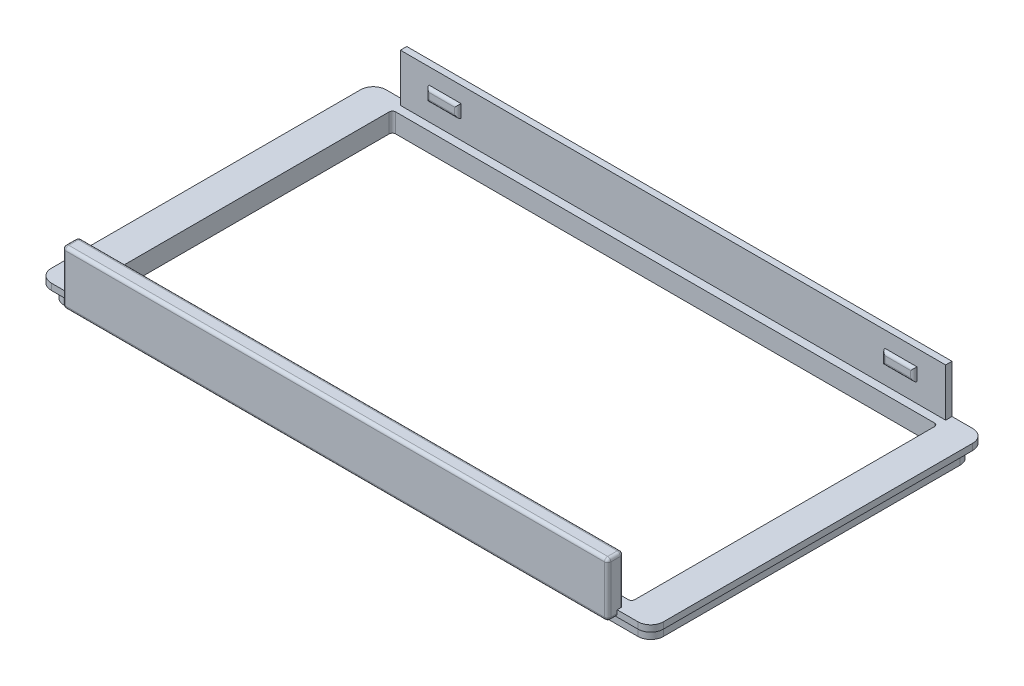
SolidWorks part; units mm, degrees
ref_plane "Спереди" through (0, 0, 0) normal (0, 0, 1) x (1, 0, 0)
ref_plane "Сверху" through (0, 0, 0) normal (0, 1, 0) x (1, 0, 0)
ref_plane "Справа" through (0, 0, 0) normal (1, 0, 0) x (0, 0, -1)
sketch "Эскиз5" plane through (0, 0, 0) normal (0, 1, 0) x (1, 0, 0)
  line L0 (46.5204, 44.0023) -> (46.5204, 145.0023)
  line L1 (46.5204, 145.0023) -> (234.5204, 145.0023)
  line L2 (234.5204, 145.0023) -> (234.5204, 44.0023)
  line L3 (234.5204, 44.0023) -> (46.5204, 44.0023)
extrude "Бобышка-Вытянуть3" add sketch "Эскиз5" along normal blind 21
sketch "Эскиз6" plane through (0, 21, 0) normal (0, 1, 0) x (1, 0, 0)
  line L0 (46.5204, 145.0023) -> (46.5204, 147.0023)
  line L1 (46.5204, 147.0023) -> (44.5204, 147.0023)
  line L2 (44.5204, 147.0023) -> (44.5204, 42.0023)
  line L3 (44.5204, 42.0023) -> (236.5204, 42.0023)
  line L4 (236.5204, 42.0023) -> (236.5204, 147.0023)
  line L5 (236.5204, 147.0023) -> (44.5204, 147.0023)
extrude "Бобышка-Вытянуть4" add sketch "Эскиз6" against normal blind 17
sketch "Эскиз7" plane through (0, 0, 0) normal (0, -1, 0) x (-1, 0, 0)
  line L0 (-46.5204, 44.0023) -> (-46.5204, 46.5023)
  line L1 (-46.5204, 145.0023) -> (-46.5204, 44.0023) construction
  line L2 (-46.5204, 46.5023) -> (-55.0204, 46.5023)
  line L3 (-55.0204, 46.5023) -> (-226.0204, 46.5023)
  line L4 (-226.0204, 46.5023) -> (-226.0204, 142.5023)
  line L5 (-226.0204, 142.5023) -> (-55.0204, 142.5023)
  line L6 (-55.0204, 142.5023) -> (-55.0204, 46.5023)
  line L7 (-234.5204, 142.5023) -> (-226.0204, 142.5023)
  line L8 (-234.5204, 44.0023) -> (-234.5204, 145.0023) construction
  line L9 (-226.0204, 142.5023) -> (-226.0204, 145.0023)
  line L10 (-234.5204, 145.0023) -> (-46.5204, 145.0023) construction
extrude "Вырез-Вытянуть2" cut sketch "Эскиз7" against normal blind 36 contours L6 L5 L4 L3
sketch "Эскиз9" plane through (0, 21, 0) normal (0, 1, 0) x (1, 0, 0)
  line L0 (226.0204, 44.0023) -> (226.0204, 33.8541)
  line L2 (55.0204, 145.0023) -> (55.0204, 151.2006)
  line L5 (226.0204, 44.0023) -> (55.0204, 44.0023)
  line L12 (55.0204, 151.2006) -> (35.7441, 151.2006)
  line L13 (35.7441, 151.2006) -> (35.7441, 38.1605)
  line L14 (35.7441, 38.1605) -> (55.0204, 38.1605)
  line L15 (55.0204, 44.0023) -> (55.0204, 38.1605)
  line L16 (55.0204, 145.0023) -> (226.0204, 145.0023)
  line L18 (226.0204, 33.8541) -> (246.4251, 33.8541)
  line L19 (246.4251, 33.8541) -> (246.4251, 159.0612)
  line L20 (246.4251, 159.0612) -> (226.0204, 159.0612)
  line L21 (226.0204, 159.0612) -> (226.0204, 145.0023)
extrude "Вырез-Вытянуть4" cut sketch "Эскиз9" against normal blind 15 contours L5 L15 L14 L13 L12 L2 L16 L21 L20 L19 L18 L0
fillet "Скругление1" radius 4 8 edges at (44.5204, 5, -42.0023) (46.5204, 2, -44.0023) (44.5204, 5, -147.0023) (46.5204, 2, -145.0023) (236.5204, 5, -147.0023) (236.5204, 5, -42.0023) (234.5204, 2, -44.0023) (234.5204, 2, -145.0023)
fillet "Скругление2" radius 1 4 edges at (55.0204, 3, -142.5023) (55.0204, 3, -46.5023) (226.0204, 3, -142.5023) (226.0204, 3, -46.5023)
sketch "Эскиз10" plane through (0, 0, -44.0023) normal (0, 0, -1) x (-1, 0, 0)
  line L0 (-51.0228, 5.9991) -> (-64.0228, 5.9991)
  line L1 (-64.0228, 5.9991) -> (-64.0228, 11.9991)
  line L2 (-64.0228, 11.9991) -> (-74.0228, 11.9991)
  line L3 (-74.0228, 11.9991) -> (-74.0228, 15.9991)
  line L4 (-74.0228, 15.9991) -> (-64.0228, 15.9991)
  line L5 (-64.0228, 15.9991) -> (-64.0228, 11.9991)
  line L6 (-51.0228, 5.9991) -> (-140.5204, 6)
  line L7 (-226.0204, 6) -> (-55.0204, 6) construction
  line L9 (-217.0179, 15.9991) -> (-217.0179, 11.9991)
  line L10 (-207.0179, 15.9991) -> (-217.0179, 15.9991)
  line L11 (-207.0179, 11.9991) -> (-207.0179, 15.9991)
  line L12 (-217.0179, 11.9991) -> (-207.0179, 11.9991)
sketch "Эскиз11" plane through (0, 0, -44.0023) normal (0, 0, -1) x (-1, 0, 0)
  line L3 (-217.0204, 12) -> (-207.0204, 12)
  line L4 (-207.0204, 12) -> (-207.0204, 16)
  line L5 (-207.0204, 16) -> (-217.0204, 16)
  line L6 (-217.0204, 16) -> (-217.0204, 12)
  line L13 (-64.0204, 12) -> (-74.0204, 12)
  line L14 (-74.0204, 12) -> (-74.0204, 16)
  line L15 (-74.0204, 16) -> (-64.0204, 16)
  line L16 (-64.0204, 16) -> (-64.0204, 12)
extrude "Бобышка-Вытянуть9" add sketch "Эскиз11" along normal blind 1 contours L16 L15 L14 L13 | L3 L4 L5 L6
fillet "Скругление7" radius 1 8 edges at (69.0204, 12, -45.0023) (74.0204, 14, -45.0023) (69.0204, 16, -45.0023) (64.0204, 14, -45.0023) (212.0204, 16, -45.0023) (207.0204, 14, -45.0023) (212.0204, 12, -45.0023) (217.0204, 14, -45.0023)
sketch "Эскиз12" plane through (0, 0, -145.0023) normal (0, 0, 1) x (1, 0, 0)
  line L3 (64.0204, 12) -> (64.0204, 16)
  line L4 (64.0204, 16) -> (74.0204, 16)
  line L5 (74.0204, 16) -> (74.0204, 12)
  line L6 (74.0204, 12) -> (64.0204, 12)
  line L8 (217.0204, 12) -> (207.0204, 12)
  line L9 (207.0204, 12) -> (207.0204, 16)
  line L10 (207.0204, 16) -> (217.0204, 16)
  line L11 (217.0204, 16) -> (217.0204, 12)
extrude "Бобышка-Вытянуть10" add sketch "Эскиз12" along normal blind 1 contours L11 L10 L9 L8 | L3 L4 L5 L6
fillet "Скругление8" radius 1 8 edges at (212.0204, 12, -144.0023) (207.0204, 14, -144.0023) (212.0204, 16, -144.0023) (217.0204, 14, -144.0023) (64.0204, 14, -144.0023) (69.0204, 16, -144.0023) (74.0204, 14, -144.0023) (69.0204, 12, -144.0023)
sketch "Эскиз13" plane through (0, 0, -42.0023) normal (0, 0, 1) x (1, 0, 0)
  line L0 (55.0204, 21) -> (55.0204, 4)
  line L1 (48.5204, 4) -> (232.5204, 4) construction
  line L2 (55.0204, 4) -> (226.0204, 4)
  line L3 (226.0204, 4) -> (226.0204, 21)
  line L4 (226.0204, 21) -> (226.0204, 6) construction
  line L5 (55.0204, 21) -> (226.0204, 21) construction
  line L6 (226.0204, 21) -> (55.0204, 21)
extrude "Бобышка-Вытянуть11" add sketch "Эскиз13" along normal blind 3
fillet "Скругление9" radius 1 11 edges at (226.0204, 12.5, -39.0023) (140.5204, 4, -39.0023) (55.0204, 12.5, -39.0023) (140.5204, 21, -39.0023) (226.0204, 21, -41.5023) (55.0204, 21, -41.5023) (55.0204, 13.5, -44.0023) (226.0204, 13.5, -44.0023) (140.5204, 21, -44.0023) (226.0204, 4, -40.5023) (55.0204, 4, -40.5023)
extrude "Бобышка-Вытянуть8" add sketch "Эскиз10" along normal blind 1 contours L9 L12 L11 L10 | L2 L3 L4 L5
fillet "Скругление6" radius 1
